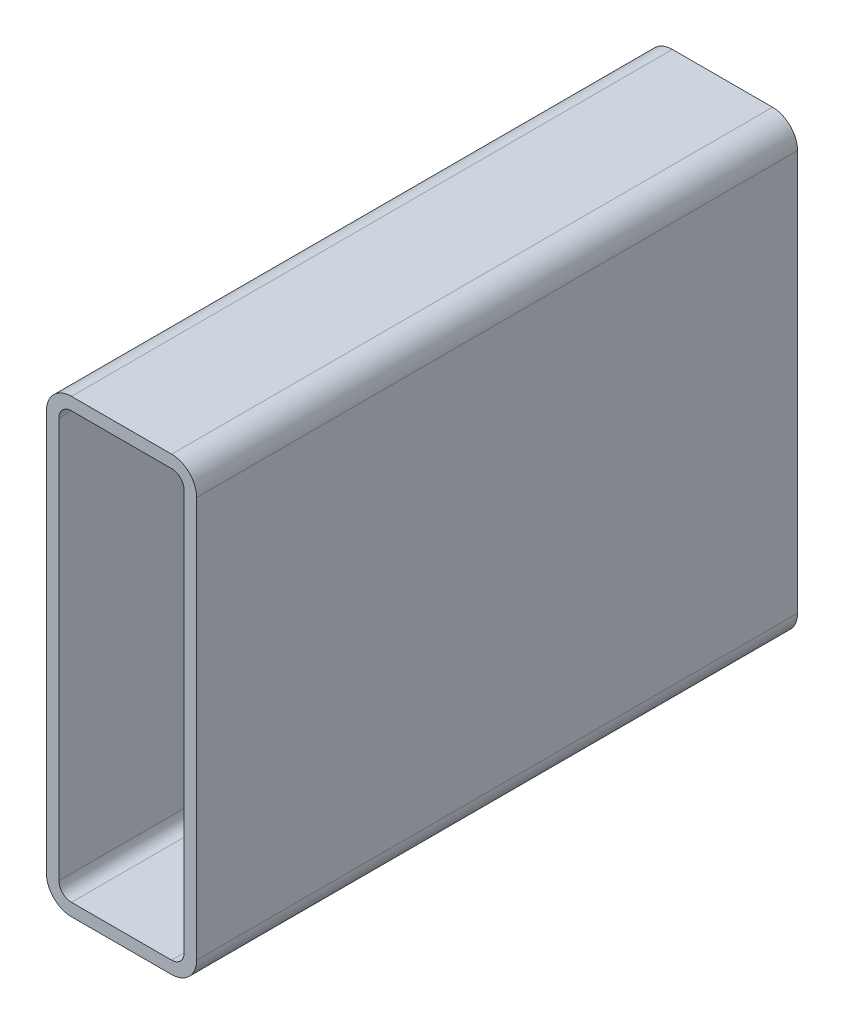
SolidWorks part; units mm, degrees
ref_plane "Front Plane" through (0, 0, 0) normal (0, 0, 1) x (1, 0, 0)
ref_plane "Top Plane" through (0, 0, 0) normal (0, 1, 0) x (1, 0, 0)
ref_plane "Right Plane" through (0, 0, 0) normal (1, 0, 0) x (0, 0, -1)
sketch "Sketch1" plane through (0, 0, 0) normal (0, 0, 1) x (1, 0, 0)
sketch_block_instance "HSS9x3x0.250-1"
sketch_block "HSS9x3x0.250"
extrude "Boss-Extrude1" add sketch "Sketch1" along normal blind 304.8
